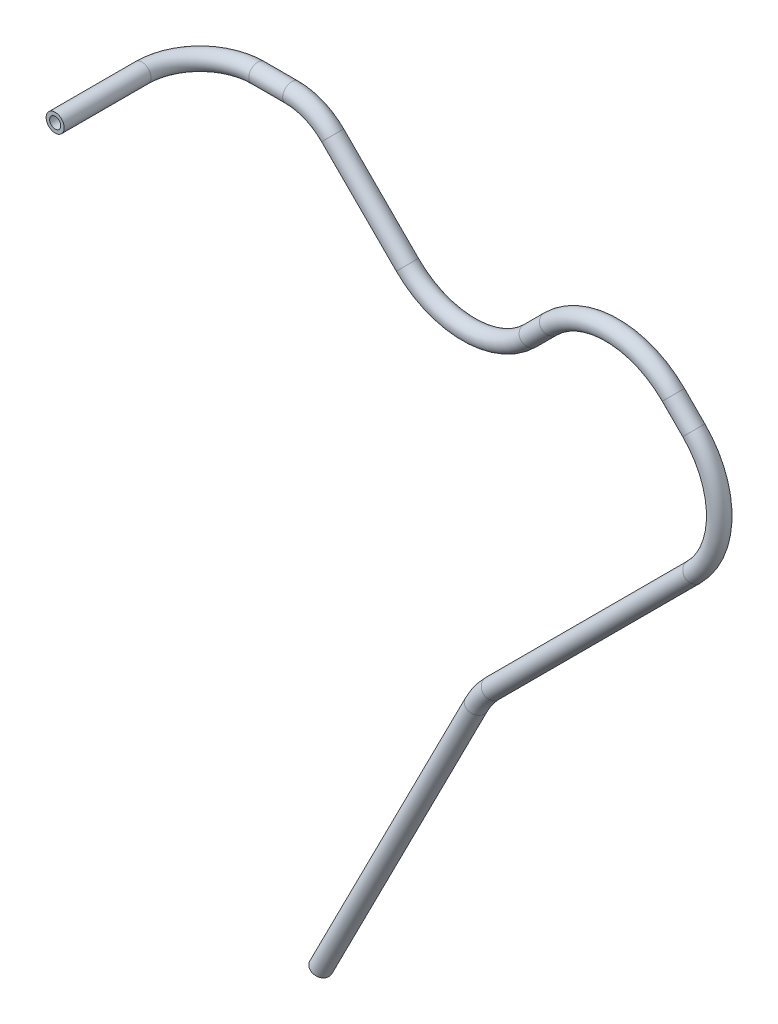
SolidWorks part; units mm, degrees
ref_plane "Front" through (0, 0, 0) normal (0, 0, 1) x (1, 0, 0)
ref_plane "Top" through (0, 0, 0) normal (0, 1, 0) x (1, 0, 0)
ref_plane "Right" through (0, 0, 0) normal (1, 0, 0) x (0, 0, -1)
sketch "Sketch1" plane through (0, 0, 0) normal (0, 0, 1) x (1, 0, 0)
  circle A0 centre (0, 0) radius 7.9375
  circle A1 centre (0, 0) radius 4.8641
  dimension "D1" = 15.875
  dimension "D2" = 9.7282
sketch3d "3DSketch2"
  line L0 (0, 0, 0) -> (0, 0, -76.2)
  line L1 (50.8, 0, -127) -> (80.558, 0, -127)
  line L2 (116.479, -14.879, -127) -> (182.0584, -80.4584, -127)
  line L3 (289.8214, -80.4584, -127) -> (307.6674, -62.6124, -127)
  line L4 (415.4305, -62.6124, -127) -> (433.391, -80.5729, -127)
  line L5 (433.391, -188.336, -127) -> (256.5778, -365.1492, -127)
  line L6 (242.5612, -384.4433, -127) -> (106.1472, -652.2361, -127)
  arc A0 (50.8, 0, -127) -> (0, 0, -76.2) centre (50.8, 0, -76.2) ccw
  arc A1 (116.479, -14.879, -127) -> (80.558, 0, -127) centre (80.558, -50.8, -127) ccw
  arc A2 (415.4305, -62.6124, -127) -> (307.6674, -62.6124, -127) centre (361.5489, -116.494, -127) ccw
  arc A3 (289.8214, -80.4584, -127) -> (182.0584, -80.4584, -127) centre (235.9399, -26.5768, -127) ccw
  arc A4 (433.391, -188.336, -127) -> (433.391, -80.5729, -127) centre (379.5094, -134.4545, -127) ccw
  arc A5 (256.5778, -365.1492, -127) -> (242.5612, -384.4433, -127) centre (310.4593, -419.0307, -127) ccw
  point P6 (0, 0, -127)
  point P7 (50.8, 50.8, -76.2)
  point P11 (101.6, 0, -127)
  point P12 (80.558, -50.8, -76.2)
  point P18 (361.5489, -8.7309, -127)
  point P19 (361.5489, -116.494, -50.8)
  point P22 (235.9399, -134.3399, -127)
  point P23 (235.9399, -26.5768, -203.2)
  point P26 (487.2725, -134.4545, -127)
  point P27 (379.5094, -134.4545, -50.8)
  point P31 (248.0411, -373.6859, -127)
  point P32 (310.4593, -419.0307, -50.8)
  dimension "D1" = 50.8
  dimension "D3" = 50.8
  dimension "D8" = 76.2
  dimension "D9" = 76.2
  dimension "D7" = 76.2
  dimension "D2" = 135
  dimension "D4" = 101.6
  dimension "D5" = 127
  dimension "D6" = 177.8
sweep "Sweep1" add profiles "Sketch1" path "3DSketch2"
